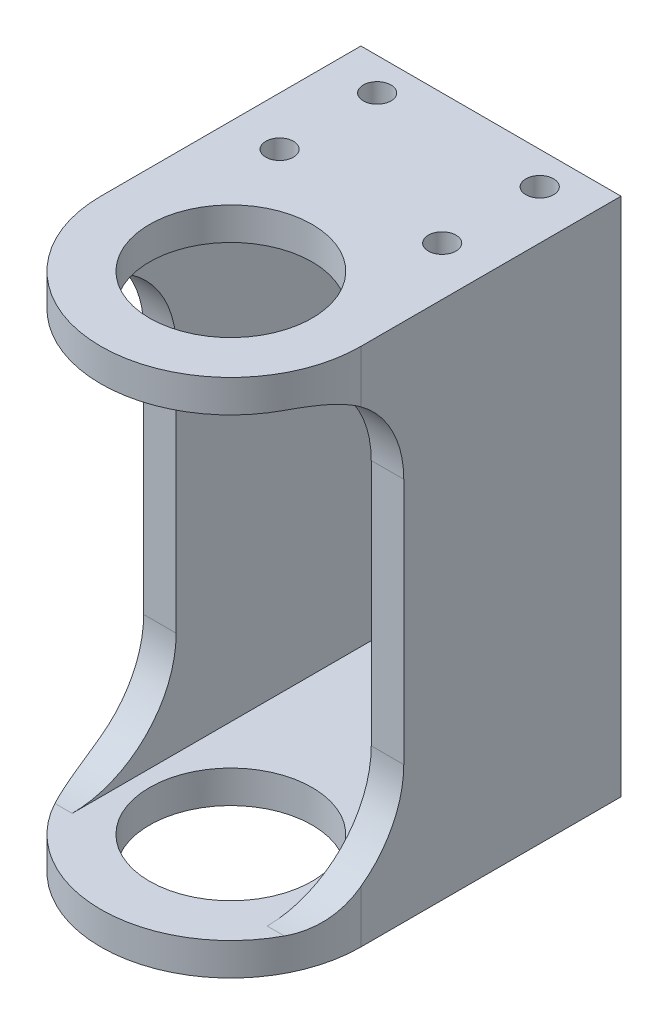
SolidWorks part; units mm, degrees
ref_plane "Front" through (0, 0, 0) normal (0, 0, 1) x (1, 0, 0)
ref_plane "Top" through (0, 0, 0) normal (0, 1, 0) x (1, 0, 0)
ref_plane "Right" through (0, 0, 0) normal (1, 0, 0) x (0, 0, -1)
sketch "Sketch1" plane through (0, 0, 0) normal (0, 0, 1) x (1, 0, 0)
  line L0 (12.7, 25.4) -> (-12.7, -25.4) construction
  line L1 (-12.7, 25.4) -> (12.7, 25.4)
  line L2 (-12.7, 25.4) -> (-12.7, -25.4)
  line L3 (-12.7, -25.4) -> (12.7, -25.4)
  line L4 (12.7, 25.4) -> (12.7, -25.4)
  line L5 (-9.525, 22.225) -> (9.525, 22.225)
  line L6 (9.525, 22.225) -> (9.525, -22.225)
  line L7 (-9.525, -22.225) -> (9.525, -22.225)
  line L8 (-9.525, 22.225) -> (-9.525, -22.225)
  dimension "D1" = 25.4
  dimension "D2" = 50.8
  dimension "D3" = 3.175
extrude "Extrude1" add sketch "Sketch1" along normal blind 38.1
sketch "Sketch2" plane through (0, 25.4, 0) normal (0, 1, 0) x (-1, 0, 0)
  line L0 (12.7, 38.1) -> (12.7, 0) construction
  line L1 (-12.7, 38.1) -> (-12.7, 0) construction
  line L2 (-12.7, 19.05) -> (-12.7, 25.4)
  line L3 (12.7, 25.4) -> (12.7, 19.05)
  line L4 (0, 25.4) -> (0, 0) construction
  line L8 (-12.7, 38.1) -> (12.7, 38.1) construction
  line L9 (-12.7, 19.05) -> (-20.9854, 19.05)
  line L10 (-20.9854, 19.05) -> (-20.9854, 39.4161)
  line L11 (-20.9854, 39.4161) -> (20.4688, 39.4161)
  line L12 (20.4688, 39.4161) -> (12.7, 19.05)
  circle A0 centre (0, 25.4) radius 7.9375
  arc A2 (-12.7, 25.4) -> (12.7, 25.4) centre (0, 25.4) cw
  dimension "D1" = 12.7
  dimension "D3" = 15.875
extrude "Cut-Extrude1" cut sketch "Sketch2" against normal through all
sketch "Sketch3" plane through (12.7, 0, 0) normal (1, 0, 0) x (0, 0, -1)
  line L0 (-33.8003, 22.225) -> (0, 22.225) construction
  line L1 (-45.5234, -22.225) -> (-21.2146, -22.225)
  line L2 (-45.5234, -22.225) -> (-45.5234, 22.225)
  line L3 (-45.5234, 22.225) -> (-21.2146, 22.225)
  line L4 (-21.2146, -22.225) -> (-21.2146, 22.225)
  line L5 (-33.8003, -22.225) -> (0, -22.225) construction
extrude "Cut-Extrude2" cut sketch "Sketch3" against normal through all
hole_wizard "#6-32 Tapped Hole1" positions "Sketch5" profile "Sketch4" tap size "#6-32" standard "Ansi Inch"
sketch "Sketch5" plane through (-2.4347, 25.4, -0.9015) normal (0, -1, 0) x (1, 0, 0)
  line L0 (2.4347, 0.9015) -> (2.4347, 13.9241) construction
  line L1 (-10.2653, 0.9015) -> (15.1347, 0.9015) construction
  circle A0 centre (2.4347, 26.3015) radius 7.9375 construction
  point P0 (10.3722, 13.6015)
  point P1 (10.3722, 4.0765)
  point P10 (-5.5028, 4.0765)
  point P11 (-5.5028, 13.6015)
  dimension "D3" = 12.7
  dimension "D1" = 15.875
  dimension "D2" = 9.525
sketch "Sketch4" plane through (7.9375, 25.4, 12.7) normal (1, 0, 0) x (0, 0, 1)
  line L0 (0, 0) -> (0, 3.175)
  line L1 (0, 3.175) -> (1.3525, 3.175)
  line L2 (1.3525, 3.175) -> (1.3525, 0)
  line L5 (1.3525, 0) -> (0, 0)
  line L11 (0, -6.35) -> (0, 107.95) construction
  dimension "Thru Tap Drill Dia." = 2.7051
  dimension "Thru Tap Drill Depth" = 3.175
fillet "Fillet2" radius 10.16 4 edges at (11.1125, 22.225, 21.2146) (-11.1125, 22.225, 21.2146) (-11.1125, -22.225, 21.2146) (11.1125, -22.225, 21.2146)
